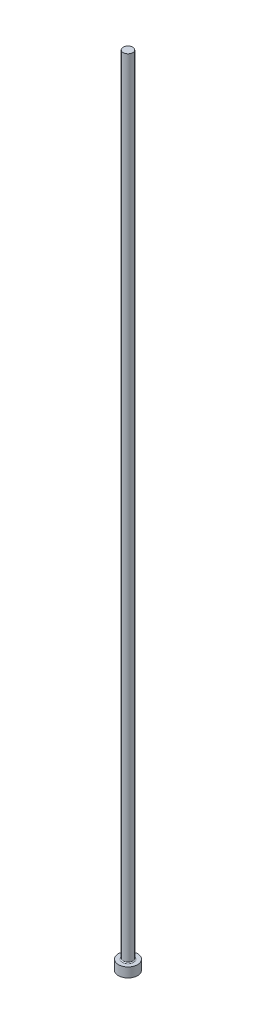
SolidWorks part; units mm, degrees
ref_plane "Plano frontal" through (0, 0, 0) normal (0, 0, 1) x (1, 0, 0)
ref_plane "Plano superior" through (0, 0, 0) normal (0, 1, 0) x (1, 0, 0)
ref_plane "Plano direito" through (0, 0, 0) normal (1, 0, 0) x (0, 0, -1)
sketch "Esboço1" plane through (0, 0, 0) normal (0, 0, 1) x (1, 0, 0)
  line L0 (0, 0) -> (3, 0)
  line L1 (3, 0) -> (3, 3)
  line L2 (3, 3) -> (1.8, 3)
  line L3 (1.5, 3.3) -> (1.5, 250)
  line L4 (1.5, 250) -> (0, 250)
  line L5 (0, 250) -> (0, 0) construction
  line L6 (0, 0) -> (0, 250)
  arc A0 (1.8, 3) -> (1.5, 3.3) centre (1.8, 3.3) cw
  dimension "D3" = 0.3
  dimension "D1" = 6
  dimension "D2" = 3
  dimension "D4" = 3
  dimension "D5" = 250
revolve "Revolução1" add sketch "Esboço1" angle 360 about L5
sketch "Esboço2"
  dimension "D1" = 1.6125
  dimension "D2" = 0.3375
  dimension "D3" = 0.525
  dimension "D4" = 0.225
wrap "Envolver1" sketch "Esboço2" wrap type deboss source sketch "Esboço2" thickness 0.1 parameters "D1"=0.1
